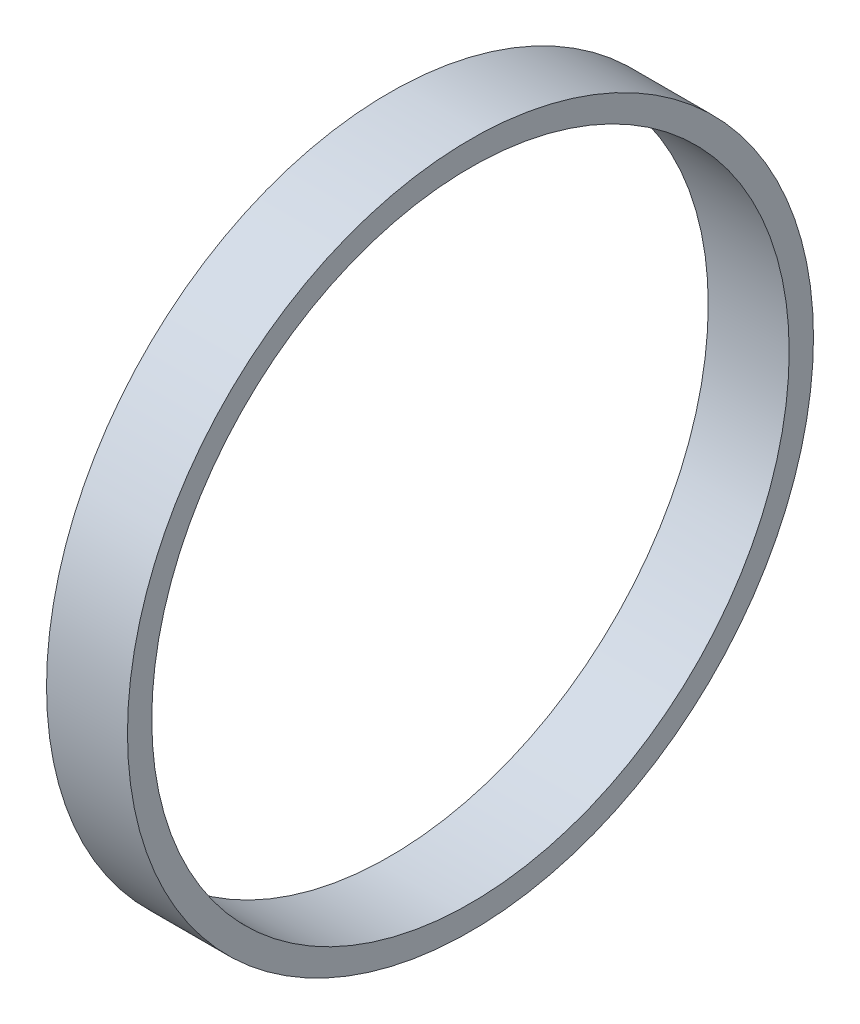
SolidWorks part; units mm, degrees
ref_plane "Face" through (0, 0, 0) normal (0, 0, 1) x (1, 0, 0)
ref_plane "Dessus" through (0, 0, 0) normal (0, 1, 0) x (1, 0, 0)
ref_plane "Droite" through (0, 0, 0) normal (1, 0, 0) x (0, 0, -1)
sketch "Esquisse1" plane through (0, 0, 0) normal (0, 0, 1) x (1, 0, 0)
  line L0 (0, 0) -> (14.114, 0) construction
  line L1 (0, 31.5) -> (8, 31.5)
  line L2 (0, 31.5) -> (0, 33.9)
  line L3 (0, 33.9) -> (8, 33.9)
  line L4 (8, 31.5) -> (8, 33.9)
  dimension "D1" = 31.5
  dimension "D2" = 33.9
  dimension "D3" = 8
revolve "Révolution1" add sketch "Esquisse1" angle 360 about L0
